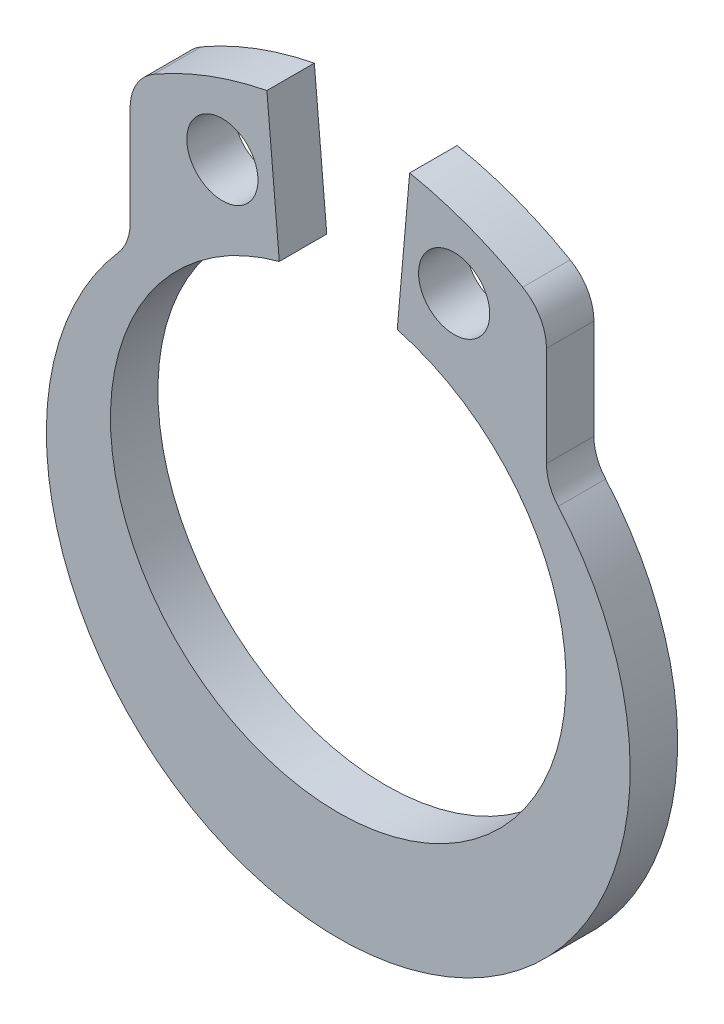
SolidWorks part; units mm, degrees
extrude "Base-Extrude" add sketch "Sketch1" along normal blind 1
sketch "Sketch1" plane through (0, 0, 0) normal (0, 0, 1) x (1, 0, 0)
  line L0 (0, 0.9398) -> (1.2423, 5.5762) construction
  line L1 (0, 0.9398) -> (-1.2423, 5.5762) construction
  line L2 (-4.386, 6.8044) -> (-4.386, 4.7026)
  line L3 (4.386, 4.7026) -> (4.386, 6.8044)
  line L4 (-1.2423, 5.5762) -> (-1.5038, 8.5648)
  line L5 (1.2423, 5.5762) -> (1.5038, 8.5648)
  line L6 (0, 0.9398) -> (3.386, 6.8044) construction
  line L7 (0, 0.9398) -> (-3.386, 6.8044) construction
  line L8 (2.4415, 6.8342) -> (0, 0.9398) construction
  line L9 (-2.4415, 6.8342) -> (0, 0.9398) construction
  arc A0 (-4.6327, 4.0449) -> (4.6327, 4.0449) centre (0, 0) ccw
  arc A1 (-1.2423, 5.5762) -> (1.2423, 5.5762) centre (0, 0.9398) ccw
  arc A2 (-3.886, 7.6705) -> (-1.5038, 8.5648) centre (0, 0.9398) cw
  arc A3 (1.5038, 8.5648) -> (3.886, 7.6705) centre (0, 0.9398) cw
  arc A4 (-4.386, 4.7026) -> (-4.6327, 4.0449) centre (-5.386, 4.7026) cw
  arc A5 (-3.886, 7.6705) -> (-4.386, 6.8044) centre (-3.386, 6.8044) ccw
  arc A6 (4.6327, 4.0449) -> (4.386, 4.7026) centre (5.386, 4.7026) cw
  arc A7 (4.386, 6.8044) -> (3.886, 7.6705) centre (3.386, 6.8044) ccw
  circle A8 centre (-2.4415, 6.8342) radius 0.75
  circle A9 centre (2.4415, 6.8342) radius 0.75
  dimension "D1" = 9.6
  dimension "D2" = 12.3
  dimension "D7" = 3
  dimension "D8" = 1
  dimension "D9" = 1.5
  dimension "D10" = 6.38
  dimension "D3" = 0.9398
  dimension "D4" = 30
  dimension "D5" = 60
  dimension "D6" = 10
  dimension "D11" = 45
ref_plane "Plane1" through (0, 0, 0) normal (0, 0, 1) x (1, 0, 0)
ref_plane "Plane2" through (0, 0, 0) normal (0, 1, 0) x (-1, 0, 0)
ref_plane "Plane3" through (0, 0, 0) normal (1, 0, 0) x (0, 0, -1)
